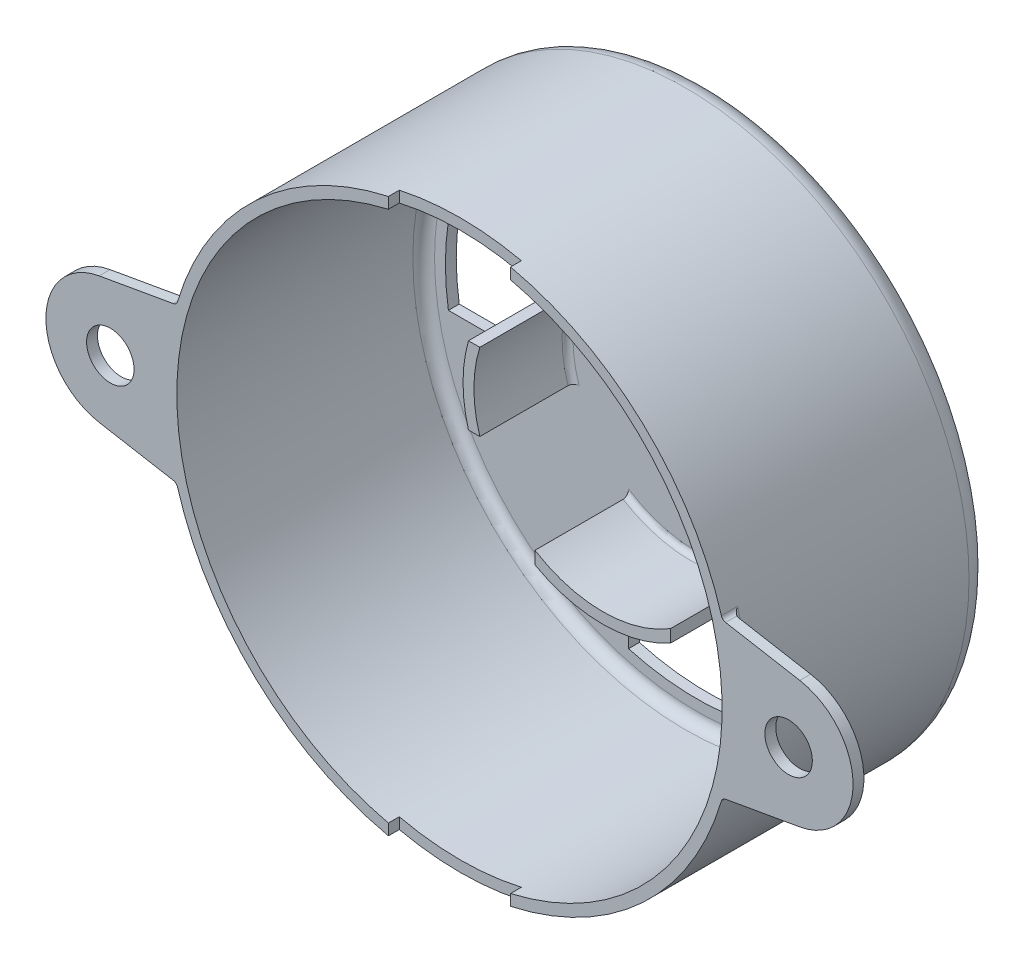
SolidWorks part; units mm, degrees
ref_plane "Face" through (0, 0, 0) normal (0, 0, 1) x (1, 0, 0)
ref_plane "Dessus" through (0, 0, 0) normal (0, 1, 0) x (1, 0, 0)
ref_plane "Droite" through (0, 0, 0) normal (1, 0, 0) x (0, 0, -1)
sketch "Esquisse1" plane through (0, 0, 0) normal (0, 0, 1) x (1, 0, 0)
  circle A0 centre (0, 11) radius 20.1
  circle A1 centre (0, 11) radius 20.9
  dimension "D1" = 40.2
  dimension "D2" = 0.8
extrude "Boss.-Extru.1" add sketch "Esquisse1" against normal blind 19
sketch "Esquisse2" plane through (0, 0, -19) normal (0, 0, -1) x (-1, 0, 0)
  circle A0 centre (0, 11) radius 20.1 construction
  circle A1 centre (0, 11) radius 20.1
extrude "Boss.-Extru.2" add sketch "Esquisse2" against normal blind 0.8
fillet "Congé1" radius 1.6 1 edges at (20.9, 11, -19)
fillet "Congé2" radius 0.8 1 edges at (-20.1, 11, -18.2)
sketch "Esquisse4" plane through (0, 0, -19) normal (0, 0, -1) x (-1, 0, 0)
  line L0 (0, 40.4784) -> (0, -16.4156) construction
  line L1 (0, 40.4784) -> (0, -16.4156) construction
  line L2 (-27.4659, 11) -> (29.4742, 11) construction
  line L3 (-9.0624, 8.15) -> (-18.2792, 8.15)
  line L5 (-18.2792, 13.85) -> (-9.0624, 13.85)
  line L6 (9.0624, 8.15) -> (18.2792, 8.15)
  line L8 (18.2792, 13.85) -> (9.0624, 13.85)
  line L9 (-5, 28.8115) -> (-5, 19.0777)
  line L10 (-5, 2.9223) -> (-5, -6.8115)
  line L11 (5, -6.8115) -> (5, 2.9223)
  line L12 (5, 19.0777) -> (5, 28.8115)
  arc A0 (-9.0624, 13.85) -> (-9.0624, 8.15) centre (0, 11) ccw
  arc A1 (9.0624, 8.15) -> (9.0624, 13.85) centre (0, 11) ccw
  arc A2 (-18.2792, 13.85) -> (-18.2792, 8.15) centre (0, 11) ccw
  arc A3 (18.2792, 8.15) -> (18.2792, 13.85) centre (0, 11) ccw
  arc A4 (-5, 28.8115) -> (5, 28.8115) centre (0, 11) cw
  arc A5 (-5, -6.8115) -> (5, -6.8115) centre (0, 11) ccw
  arc A6 (-5, 19.0777) -> (5, 19.0777) centre (0, 11) cw
  arc A7 (-5, 2.9223) -> (5, 2.9223) centre (0, 11) ccw
  dimension "D1" = 19
  dimension "D3" = 37
  dimension "D2" = 5.7
  dimension "D4" = 10
extrude "Enlèv. mat.-Extru.1" cut sketch "Esquisse4" against normal through all
sketch "Esquisse6" plane through (0, 0, -19) normal (0, 0, -1) x (-1, 0, 0)
  line L0 (-5, 2.9223) -> (-5, -6.8115) construction
  line L1 (5, -6.8115) -> (5, 2.9223) construction
  line L2 (9.0624, 8.15) -> (18.2792, 8.15) construction
  line L3 (18.2792, 13.85) -> (9.0624, 13.85) construction
  line L4 (5, 19.0777) -> (5, 28.8115) construction
  line L5 (-5, 28.8115) -> (-5, 19.0777) construction
  line L6 (-18.2792, 8.15) -> (-9.0624, 8.15) construction
  line L7 (-9.0624, 13.85) -> (-18.2792, 13.85) construction
  line L8 (-5, 2.9223) -> (-5, 1.995)
  line L9 (5, 1.995) -> (5, 2.9223)
  line L10 (9.0624, 8.15) -> (9.8979, 8.15)
  line L11 (9.8979, 13.85) -> (9.0624, 13.85)
  line L12 (5, 19.0777) -> (5, 20.005)
  line L13 (-5, 20.005) -> (-5, 19.0777)
  line L14 (-9.8979, 8.15) -> (-9.0624, 8.15)
  line L15 (-9.0624, 13.85) -> (-9.8979, 13.85)
  arc A0 (9.0624, 8.15) -> (9.0624, 13.85) centre (0, 11) ccw construction
  arc A1 (-5, 2.9223) -> (5, 2.9223) centre (0, 11) ccw construction
  arc A2 (-9.0624, 13.85) -> (-9.0624, 8.15) centre (0, 11) ccw construction
  arc A3 (5, 19.0777) -> (-5, 19.0777) centre (0, 11) ccw construction
  arc A4 (9.0624, 8.15) -> (9.0624, 13.85) centre (0, 11) ccw
  arc A5 (-5, 2.9223) -> (5, 2.9223) centre (0, 11) ccw
  arc A6 (-9.0624, 13.85) -> (-9.0624, 8.15) centre (0, 11) ccw
  arc A7 (5, 19.0777) -> (-5, 19.0777) centre (0, 11) ccw
  arc A8 (-9.8979, 13.85) -> (-9.8979, 8.15) centre (0, 11) ccw
  arc A9 (5, 20.005) -> (-5, 20.005) centre (0, 11) ccw
  arc A10 (9.8979, 8.15) -> (9.8979, 13.85) centre (0, 11) ccw
  arc A11 (-5, 1.995) -> (5, 1.995) centre (0, 11) ccw
  arc A12 (-5.4211, 2.242) -> (5.4211, 2.242) centre (0, 11) ccw construction
  arc A13 (-9.8256, 14.09) -> (-9.8256, 7.91) centre (0, 11) ccw construction
  arc A14 (5.4211, 19.758) -> (-5.4211, 19.758) centre (0, 11) ccw construction
  arc A15 (9.8256, 7.91) -> (9.8256, 14.09) centre (0, 11) ccw construction
  dimension "D1" = 0.8
extrude "Boss.-Extru.3" add sketch "Esquisse6" against normal offset from surface (7.7 mm away) 1
fillet "Congé3" radius 0.4 4 edges at (-9.5, 11, -18.2) (0, 1.5, -18.2) (9.5, 11, -18.2) (0, 20.5, -18.2)
fillet "Congé4" radius 1.2 4 edges at (-10.3, 11, -19) (0, 21.3, -19) (0, 0.7, -19) (10.3, 11, -19)
sketch "Esquisse7" plane through (0, 0, -19) normal (0, 0, -1) x (-1, 0, 0)
  line L0 (-5, 28.8115) -> (-5, 18.6033) construction
  line L1 (-5, 28.8115) -> (-5, 23)
  line L2 (-11.1369, 22.1369) -> (0, 11) construction
  line L3 (0, 11) -> (0, 27.7831) construction
  arc A0 (-5, 23) -> (-9.1924, 20.1924) centre (0, 11) ccw
  arc A1 (-5, 28.8115) -> (-13.0815, 24.0815) centre (0, 11) ccw
  arc A2 (-13.0815, 24.0815) -> (-9.1924, 20.1924) centre (-11.1369, 22.1369) ccw
  arc A3 (5, 28.8115) -> (-5, 28.8115) centre (0, 11) ccw construction
  dimension "D2" = 5.5
  dimension "D1" = 45
extrude "Enlèv. mat.-Extru.2" cut sketch "Esquisse7" against normal through all
sketch "Esquisse8" plane through (0, 0, -19) normal (0, 0, -1) x (-1, 0, 0)
  line L0 (15.7264, 26.7264) -> (-15.7264, -4.7264) construction
  line L1 (0, 11) -> (25.5476, 11) construction
  circle A0 centre (-10.6066, 0.3934) radius 1.25
  circle A1 centre (10.6066, 21.6066) radius 2
  circle A2 centre (0, 11) radius 15 construction
  dimension "D2" = 4
  dimension "D3" = 2.5
  dimension "D4" = 30
  dimension "D1" = 45
extrude "Enlèv. mat.-Extru.3" cut sketch "Esquisse8" against normal through all
sketch "Esquisse9" plane through (0, 0, 0) normal (0, 0, 1) x (1, 0, 0)
  line L0 (0, 11) -> (34.1306, 11) construction
  line L1 (0, 11) -> (0, 33.6261) construction
  line L2 (-25.8248, 15.6778) -> (-20.1119, 16.6852)
  line L3 (-25.8248, 6.3222) -> (-20.1119, 5.3148)
  line L4 (25.8248, 15.6778) -> (20.1119, 16.6852)
  line L5 (25.8248, 6.3222) -> (20.1119, 5.3148)
  circle A0 centre (-25, 11) radius 1.75
  circle A1 centre (25, 11) radius 1.75
  arc A2 (25.8248, 6.3222) -> (25.8248, 15.6778) centre (25, 11) ccw
  arc A3 (-25.8248, 15.6778) -> (-25.8248, 6.3222) centre (-25, 11) ccw
  circle A4 centre (0, 11) radius 20.9 construction
  arc A5 (-20.1119, 16.6852) -> (-20.1119, 5.3148) centre (0, 11) ccw
  circle A6 centre (-25, 11) radius 4.75 construction
  circle A7 centre (25, 11) radius 4.75 construction
  arc A8 (20.1119, 5.3148) -> (20.1119, 16.6852) centre (0, 11) ccw
  dimension "D1" = 3.5
  dimension "D2" = 50
  dimension "D3" = 3
  dimension "D5" = 20
  dimension "D6" = 20
  dimension "D4" = 3
extrude "Boss.-Extru.4" add sketch "Esquisse9" against normal blind 0.8
fillet "Congé5" radius 0.4 6 edges at (20.9, 11, -0.8) (-20.9, 11, -0.8) (-20.1119, 16.6852, -0.4) (-20.1119, 5.3148, -0.4) (20.1119, 5.3148, -0.4) (20.1119, 16.6852, -0.4)
sketch "Esquisse10" plane through (0, 0, 0) normal (0, 0, 1) x (1, 0, 0)
  line L0 (-4.5, 30.5898) -> (-4.5, 31.6401) construction
  line L1 (4.5, 31.6401) -> (4.5, 30.5898) construction
  line L2 (-4.5, 30.5898) -> (-4.5, 31.6401)
  line L3 (4.5, 31.6401) -> (4.5, 30.5898)
  line L4 (4.5, -8.5898) -> (4.5, -9.6401) construction
  line L5 (-4.5, -8.5898) -> (-4.5, -9.6401) construction
  line L6 (4.5, -8.5898) -> (4.5, -9.6401)
  line L7 (-4.5, -8.5898) -> (-4.5, -9.6401)
  arc A0 (4.5, 31.6401) -> (-4.5, 31.6401) centre (0, 11) ccw construction
  arc A1 (4.5, 31.6401) -> (-4.5, 31.6401) centre (0, 11) ccw
  arc A2 (-4.5, -9.6401) -> (4.5, -9.6401) centre (0, 11) ccw construction
  arc A3 (-4.5, -9.6401) -> (4.5, -9.6401) centre (0, 11) ccw
  circle A4 centre (0, 11) radius 20.1 construction
  arc A5 (-4.5, -8.5898) -> (4.5, -8.5898) centre (0, 11) ccw
  arc A6 (4.5, 30.5898) -> (-4.5, 30.5898) centre (0, 11) ccw
extrude "Enlèv. mat.-Extru.4" cut sketch "Esquisse10" against normal blind 0.8
